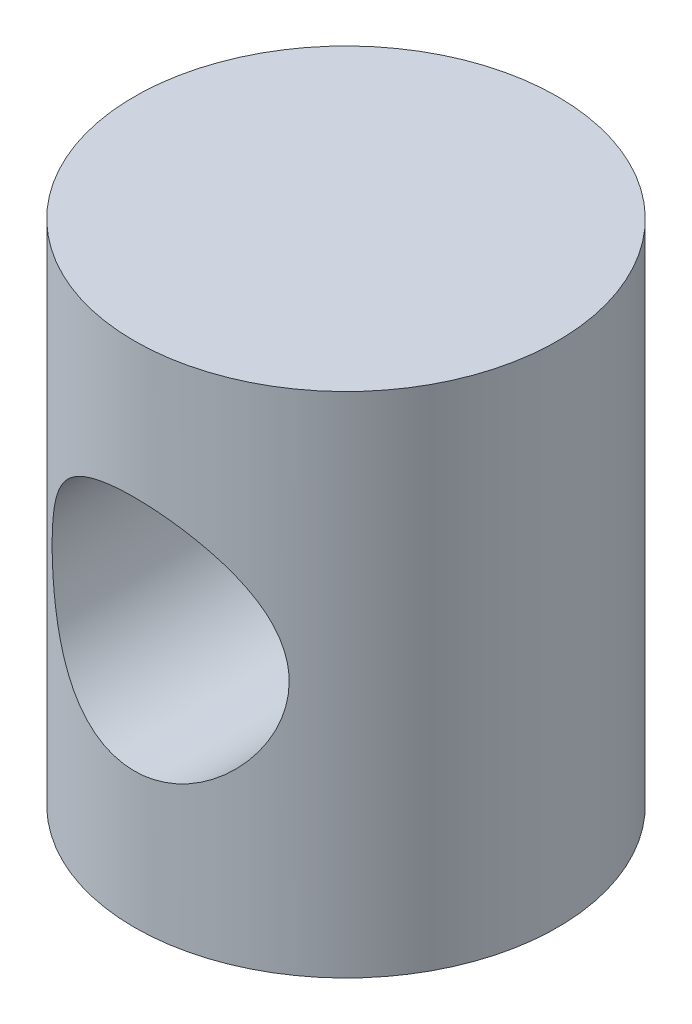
SolidWorks part; units mm, degrees
ref_plane "前视基准面" through (0, 0, 0) normal (0, 0, 1) x (1, 0, 0)
ref_plane "上视基准面" through (0, 0, 0) normal (0, 1, 0) x (1, 0, 0)
ref_plane "右视基准面" through (0, 0, 0) normal (1, 0, 0) x (0, 0, -1)
sketch "草图1" plane through (0, 0, 0) normal (0, 1, 0) x (1, 0, 0)
  circle A0 centre (0, 0) radius 50
  dimension "D1" = 100
extrude "凸台-拉伸1" add sketch "草图1" along normal blind 120
sketch "草图2" plane through (0, 0, 0) normal (0, 0, 1) x (1, 0, 0)
  line L0 (0, 120) -> (0, 0) construction
  line L1 (50, 120) -> (-50, 120) construction
  line L2 (-37.6041, 60) -> (38.3895, 60) construction
  circle A0 centre (0, 60) radius 28
  dimension "D1" = 56
extrude "切除-拉伸1" cut sketch "草图2" against normal mid plane 110
